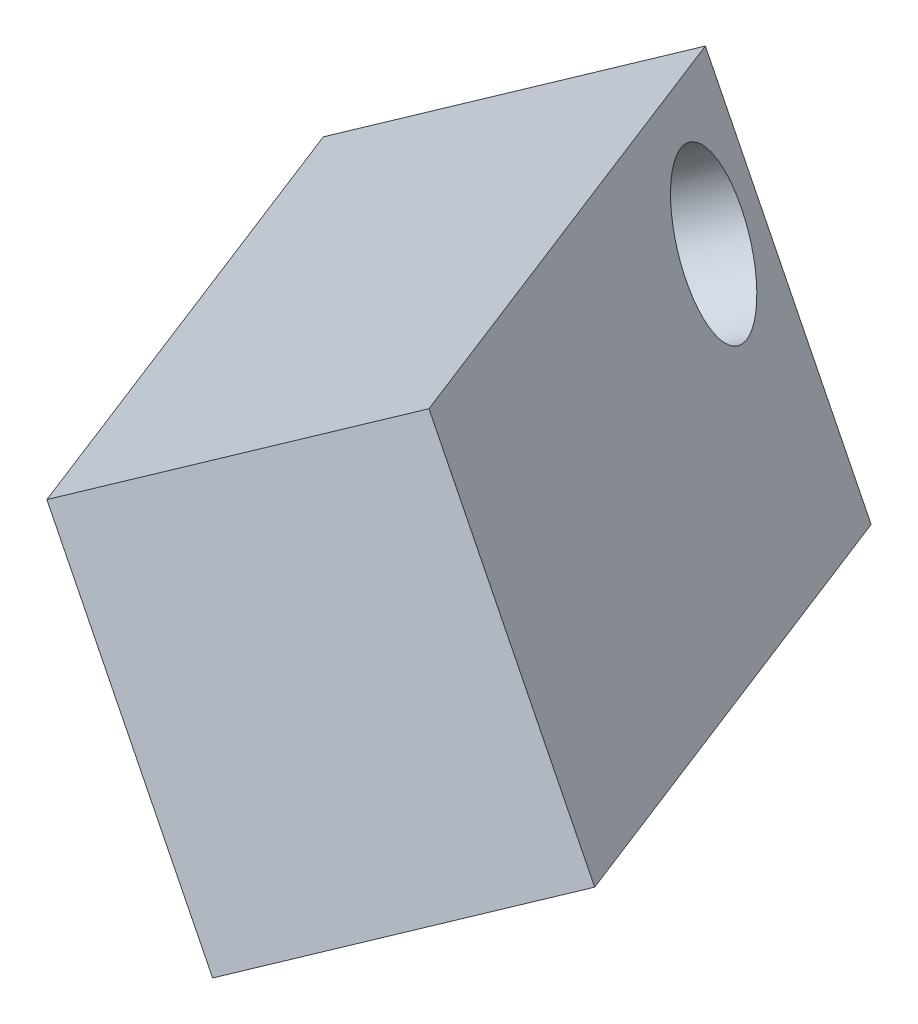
SolidWorks part; units mm, degrees
ref_plane "Ebene vorne" through (0, 0, 0) normal (0, 0, 1) x (1, 0, 0)
ref_plane "Ebene oben" through (0, 0, 0) normal (0, 1, 0) x (1, 0, 0)
ref_plane "Ebene rechts" through (0, 0, 0) normal (1, 0, 0) x (0, 0, -1)
sketch3d "3D-Skizze1"
  line L0 (0, 0, 0) -> (-300, -150, 210)
  dimension "D1" = 150
  dimension "D2" = 210
  dimension "D3" = 300
ref_plane "Ebene1" through (-300, -150, 210) normal (-0.7581, -0.379, 0.5307) x (0.4746, 0.2373, 0.8476)
sketch "Skizze1" plane through (-300, -150, 210) normal (-0.7581, -0.379, 0.5307) x (0.4746, 0.2373, 0.8476)
  line L0 (50, -50) -> (50, -100)
  line L1 (50, -50) -> (150, -50)
  line L2 (50, -100) -> (150, -100)
  line L3 (150, -50) -> (150, -100)
  dimension "D1" = 50
  dimension "D2" = 50
  dimension "D3" = 100
  dimension "D4" = 50
extrude "Aufsatz-Linear austragen1" add sketch "Skizze1" along normal blind 40
sketch "Skizze2" plane through (-300, -150, 210) normal (0.7581, 0.379, -0.5307) x (-0.4746, -0.2373, -0.8476)
  line L0 (-150, -50) -> (-50, -50) construction
  line L1 (-50, -50) -> (-50, -100) construction
  circle A0 centre (-65, -65) radius 10
  dimension "D1" = 20
  dimension "D2" = 15
  dimension "D3" = 15
extrude "Schnitt-Linear austragen1" cut sketch "Skizze2" against normal blind 40
equation "\"Breite\"=25"
equation "\"Wandstärke\"=2"
